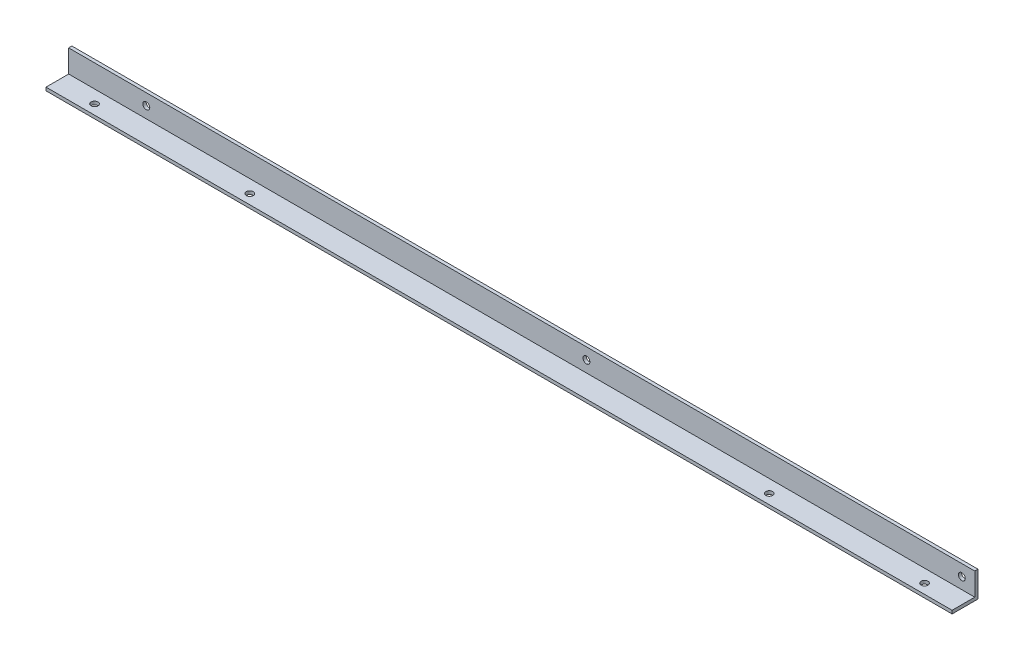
SolidWorks part; units mm, degrees
ref_plane "Front Plane" through (0, 0, 0) normal (0, 0, 1) x (1, 0, 0)
ref_plane "Top Plane" through (0, 0, 0) normal (0, 1, 0) x (1, 0, 0)
ref_plane "Right Plane" through (0, 0, 0) normal (1, 0, 0) x (0, 0, -1)
sketch "Sketch1" plane through (0, 0, 0) normal (0, 1, 0) x (1, 0, 0)
  line L1 (-444.5, 12.7) -> (444.5, 12.7)
  line L2 (-444.5, 12.7) -> (-444.5, -12.7)
  line L3 (-444.5, -12.7) -> (444.5, -12.7)
  line L4 (444.5, 12.7) -> (444.5, -12.7)
  line L5 (-444.5, 12.7) -> (444.5, -12.7) construction
  line L6 (-444.5, -12.7) -> (444.5, 12.7) construction
  point P0 (0, 0)
  dimension "D1" = 889
  dimension "D2" = 25.4
extrude "Boss-Extrude1" add sketch "Sketch1" along normal blind 3.175
sketch "Sketch2" plane through (0, 3.175, 0) normal (0, 1, 0) x (1, 0, 0)
  line L0 (-444.5, 12.7) -> (-444.5, 9.525)
  line L1 (-444.5, 12.7) -> (-444.5, -12.7) construction
  line L2 (-444.5, 9.525) -> (444.5, 9.525)
  line L3 (444.5, -12.7) -> (444.5, 12.7) construction
  line L4 (444.5, 9.525) -> (444.5, 12.7)
  line L5 (444.5, 12.7) -> (-444.5, 12.7)
  dimension "D1" = 3.175
extrude "Boss-Extrude2" add sketch "Sketch2" along normal blind 22.225
sketch "Sketch3" plane through (0, 3.175, 0) normal (0, 1, 0) x (1, 0, 0)
  line L0 (-444.5, -3.175) -> (444.5, -3.175) construction
  line L1 (-444.5, 9.525) -> (-444.5, -12.7) construction
  line L2 (444.5, -12.7) -> (444.5, 9.525) construction
  line L3 (-444.5, -12.7) -> (444.5, -12.7) construction
  circle A0 centre (-406.4, -3.175) radius 3.3782
  circle A1 centre (-254, -3.175) radius 3.3782
  circle A2 centre (407.9875, -3.175) radius 3.3782
  circle A3 centre (255.5875, -3.175) radius 3.3782
  dimension "D2" = 6.7564
  dimension "D3" = 6.7564
  dimension "D4" = 6.7564
  dimension "D5" = 6.7564
  dimension "D1" = 9.525
  dimension "D6" = 38.1
  dimension "D7" = 152.4
  dimension "D8" = 36.5125
  dimension "D9" = 152.4
extrude "Cut-Extrude1" cut sketch "Sketch3" against normal through all
sketch "Sketch4" plane through (0, 0, -9.525) normal (0, 0, 1) x (1, 0, 0)
  line L0 (-444.5, 14.2875) -> (444.5, 14.2875) construction
  line L1 (-444.5, 25.4) -> (-444.5, 3.175) construction
  line L2 (444.5, 25.4) -> (444.5, 3.175) construction
  line L3 (-444.5, 25.4) -> (444.5, 25.4) construction
  circle A0 centre (431.8, 14.2875) radius 3.3782
  circle A1 centre (63.5, 14.2875) radius 3.3782
  circle A2 centre (-368.3, 14.2875) radius 3.3782
  dimension "D2" = 6.7564
  dimension "D6" = 6.7564
  dimension "D7" = 6.7564
  dimension "D1" = 11.1125
  dimension "D3" = 12.7
  dimension "D4" = 76.2
  dimension "D5" = 381
extrude "Cut-Extrude2" cut sketch "Sketch4" against normal through all
